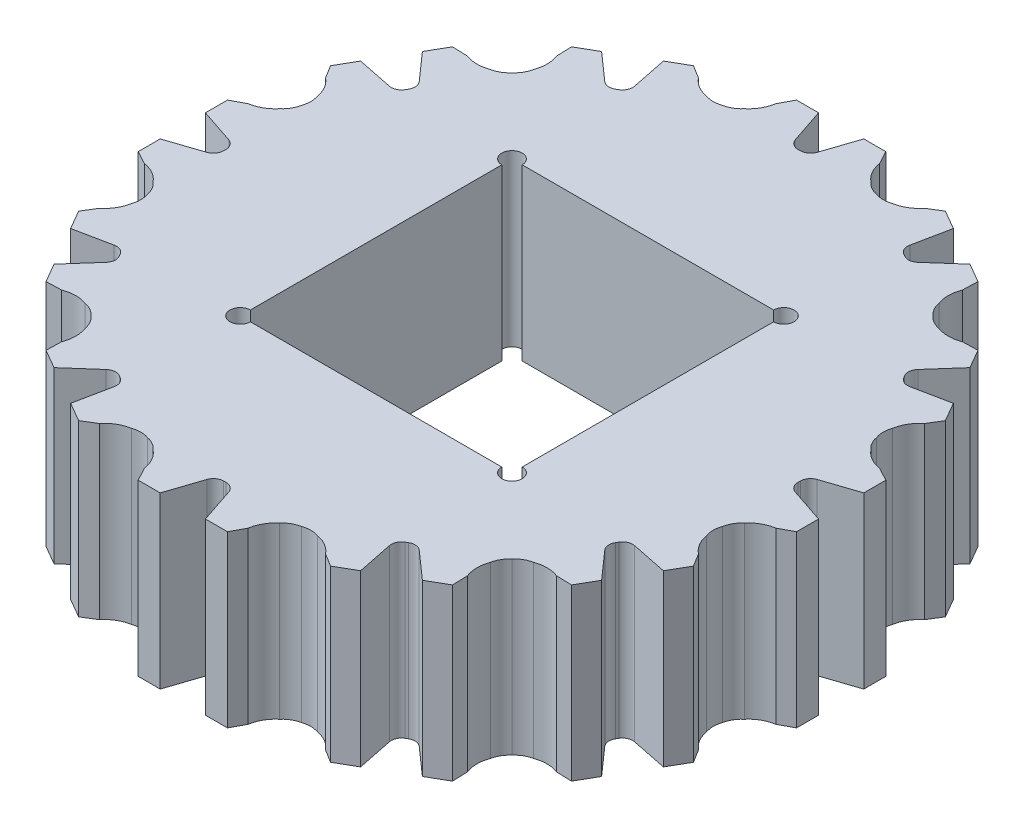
SolidWorks part; units mm, degrees
ref_plane "Ön Düzlem" through (0, 0, 0) normal (0, 0, 1) x (1, 0, 0)
ref_plane "Üst Düzlem" through (0, 0, 0) normal (0, 1, 0) x (1, 0, 0)
ref_plane "Sağ Düzlem" through (0, 0, 0) normal (1, 0, 0) x (0, 0, -1)
imported_body "Stok-25.4 YIKANABİLİR  DÜZ -1"
sketch "Çizim1" plane through (0, -10, 0) normal (0, 1, 0) x (1, 0, 0)
  line L1 (-18.5, 67) -> (18.5, 67)
  line L2 (-20, 65.5) -> (-20, 28.5)
  line L3 (-18.5, 27) -> (18.5, 27)
  line L4 (20, 65.5) -> (20, 28.5)
  line L5 (-20, 67) -> (20, 27) construction
  line L6 (-20, 27) -> (0, 47) construction
  arc A0 (-18.5, 67) -> (-20, 65.5) centre (-20, 67) ccw
  arc A1 (20, 65.5) -> (18.5, 67) centre (20, 67) ccw
  arc A2 (18.5, 27) -> (20, 28.5) centre (20, 27) ccw
  arc A3 (-20, 28.5) -> (-18.5, 27) centre (-20, 27) ccw
  point P0 (0, 47)
  point P1 (0, 47)
  dimension "D3" = 3
  dimension "D4" = 3
  dimension "D5" = 3
  dimension "D6" = 3
  dimension "D1" = 40
  dimension "D2" = 40
extrude "Kes-Ekstrüzyon5" cut sketch "Çizim1" against normal blind 55
